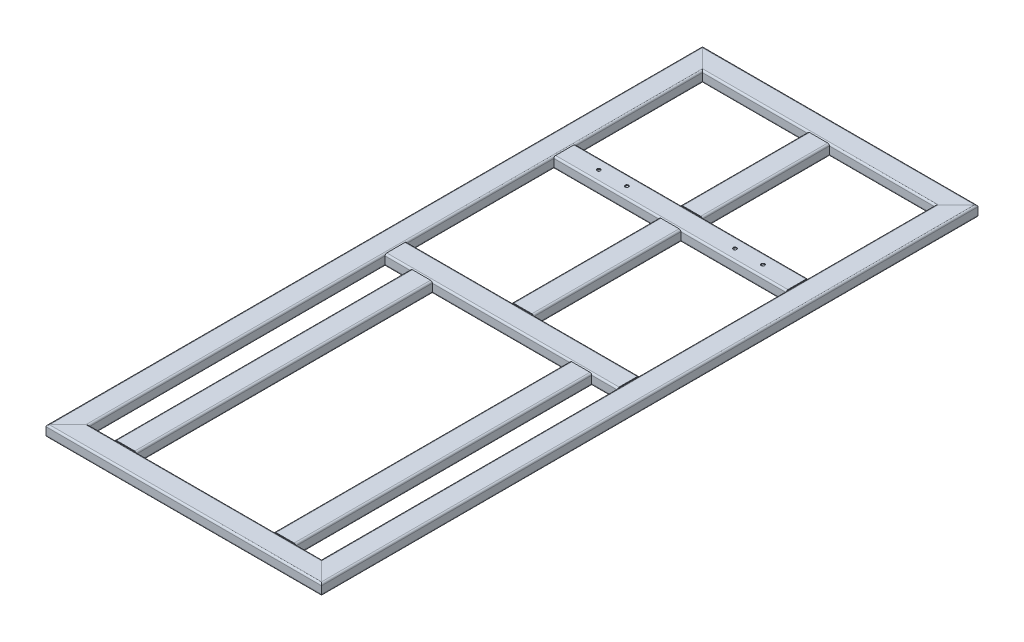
SolidWorks part; units mm, degrees
ref_plane "Piano frontale" through (0, 0, 0) normal (0, 0, 1) x (1, 0, 0)
ref_plane "Piano superiore" through (0, 0, 0) normal (0, 1, 0) x (1, 0, 0)
ref_plane "Piano destro" through (0, 0, 0) normal (1, 0, 0) x (0, 0, -1)
sketch "Schizzo1" plane through (0, 0, 0) normal (0, 1, 0) x (1, 0, 0)
  line L0 (-470, 0) -> (470, 0)
  line L1 (470, -1175) -> (-470, -1175)
  line L2 (470, -1175) -> (470, 1175)
  line L3 (470, 1175) -> (-470, 1175)
  line L4 (-470, -1175) -> (-470, 1175)
  line L5 (470, -1175) -> (-470, 1175) construction
  line L6 (470, 1175) -> (-470, -1175) construction
  line L7 (0, 625) -> (0, 0)
  line L8 (-295, 0) -> (-295, -1175)
  line L9 (295, 0) -> (295, -1175)
  line L10 (0, 0) -> (0, -1175) construction
  line L11 (105, 1135) -> (225, 1135) construction
  line L12 (-500, -1235) -> (500, -1235)
  line L13 (-105, 1135) -> (-225, 1135) construction
  line L14 (-470, 625) -> (470, 625)
  line L15 (-500, 1235) -> (500, 1235) construction
  line L16 (0, 625) -> (0, 1175)
  point P0 (0, 0)
  point P22 (0, -1235)
  dimension "D1" = 2350
  dimension "D2" = 940
  dimension "D3" = 175
  dimension "D4" = 60
  dimension "D5" = 60
  dimension "D6" = 1000
  dimension "D7" = 105
  dimension "D8" = 120
  dimension "D9" = 40
  dimension "D10" = 550
other "Tubo rettangolare 80 X 40 X 3.0(1)"
ref_plane "Piano4" through (-470, 0, 1175) normal (0, 0, -1) x (0, 1, 0)
sketch "Sketch128" plane through (-470, 0, 1175) normal (0, 0, -1) x (0, 1, 0)
  line L0 (-13.6, -37) -> (13.6, -37)
  line L1 (-17, -33.6) -> (-17, 33.6)
  line L2 (13.6, 37) -> (-13.6, 37)
  line L3 (17, 33.6) -> (17, -33.6)
  line L4 (-13.6, -40) -> (13.6, -40)
  line L5 (-20, -33.6) -> (-20, 33.6)
  line L6 (13.6, 40) -> (-13.6, 40)
  line L7 (20, 33.6) -> (20, -33.6)
  line L8 (-20, 0) -> (-17, 0) construction
  line L9 (-17, 0) -> (17, 0) construction
  line L10 (17, 0) -> (20, 0) construction
  line L11 (0, 40) -> (0, 37) construction
  line L12 (0, 37) -> (0, -37) construction
  line L13 (0, -37) -> (0, -40) construction
  arc A0 (20, 33.6) -> (13.6, 40) centre (13.6, 33.6) ccw
  arc A1 (13.6, -40) -> (20, -33.6) centre (13.6, -33.6) ccw
  arc A2 (-20, -33.6) -> (-13.6, -40) centre (-13.6, -33.6) ccw
  arc A3 (-13.6, 40) -> (-20, 33.6) centre (-13.6, 33.6) ccw
  arc A4 (-13.6, 37) -> (-17, 33.6) centre (-13.6, 33.6) ccw
  arc A5 (17, 33.6) -> (13.6, 37) centre (13.6, 33.6) ccw
  arc A6 (13.6, -37) -> (17, -33.6) centre (13.6, -33.6) ccw
  arc A7 (-17, -33.6) -> (-13.6, -37) centre (-13.6, -33.6) ccw
  point P6 (-20, 40)
  point P33 (-20, -40)
  point P34 (20, -40)
  point P36 (20, 40)
  point P37 (0, 0)
  dimension "D1" = 6.4
  dimension "Thickness" = 3
  dimension "V_leg" = 80
  dimension "H_leg" = 40
other "Tubo rettangolare 80 X 40 X 3.0(2)"
ref_plane "Piano7" through (-470, 0, 0) normal (1, 0, 0) x (0, 1, 0)
sketch "Sketch129" plane through (-470, 0, 0) normal (1, 0, 0) x (0, 1, 0)
  line L0 (-13.6, -37) -> (13.6, -37)
  line L1 (-17, -33.6) -> (-17, 33.6)
  line L2 (13.6, 37) -> (-13.6, 37)
  line L3 (17, 33.6) -> (17, -33.6)
  line L4 (-13.6, -40) -> (13.6, -40)
  line L5 (-20, -33.6) -> (-20, 33.6)
  line L6 (13.6, 40) -> (-13.6, 40)
  line L7 (20, 33.6) -> (20, -33.6)
  line L8 (-20, 0) -> (-17, 0) construction
  line L9 (-17, 0) -> (17, 0) construction
  line L10 (17, 0) -> (20, 0) construction
  line L11 (0, 40) -> (0, 37) construction
  line L12 (0, 37) -> (0, -37) construction
  line L13 (0, -37) -> (0, -40) construction
  arc A0 (20, 33.6) -> (13.6, 40) centre (13.6, 33.6) ccw
  arc A1 (13.6, -40) -> (20, -33.6) centre (13.6, -33.6) ccw
  arc A2 (-20, -33.6) -> (-13.6, -40) centre (-13.6, -33.6) ccw
  arc A3 (-13.6, 40) -> (-20, 33.6) centre (-13.6, 33.6) ccw
  arc A4 (-13.6, 37) -> (-17, 33.6) centre (-13.6, 33.6) ccw
  arc A5 (17, 33.6) -> (13.6, 37) centre (13.6, 33.6) ccw
  arc A6 (13.6, -37) -> (17, -33.6) centre (13.6, -33.6) ccw
  arc A7 (-17, -33.6) -> (-13.6, -37) centre (-13.6, -33.6) ccw
  point P6 (-20, 40)
  point P33 (-20, -40)
  point P34 (20, -40)
  point P36 (20, 40)
  point P37 (0, 0)
  dimension "D1" = 6.4
  dimension "Thickness" = 3
  dimension "V_leg" = 80
  dimension "H_leg" = 40
other "Tubo rettangolare 80 X 40 X 3.0(3)"
ref_plane "Piano11" through (-295, 0, 0) normal (0, 0, 1) x (0, 1, 0)
sketch "Sketch130" plane through (-295, 0, 0) normal (0, 0, 1) x (0, 1, 0)
  line L0 (-13.6, -37) -> (13.6, -37)
  line L1 (-17, -33.6) -> (-17, 33.6)
  line L2 (13.6, 37) -> (-13.6, 37)
  line L3 (17, 33.6) -> (17, -33.6)
  line L4 (-13.6, -40) -> (13.6, -40)
  line L5 (-20, -33.6) -> (-20, 33.6)
  line L6 (13.6, 40) -> (-13.6, 40)
  line L7 (20, 33.6) -> (20, -33.6)
  line L8 (-20, 0) -> (-17, 0) construction
  line L9 (-17, 0) -> (17, 0) construction
  line L10 (17, 0) -> (20, 0) construction
  line L11 (0, 40) -> (0, 37) construction
  line L12 (0, 37) -> (0, -37) construction
  line L13 (0, -37) -> (0, -40) construction
  arc A0 (20, 33.6) -> (13.6, 40) centre (13.6, 33.6) ccw
  arc A1 (13.6, -40) -> (20, -33.6) centre (13.6, -33.6) ccw
  arc A2 (-20, -33.6) -> (-13.6, -40) centre (-13.6, -33.6) ccw
  arc A3 (-13.6, 40) -> (-20, 33.6) centre (-13.6, 33.6) ccw
  arc A4 (-13.6, 37) -> (-17, 33.6) centre (-13.6, 33.6) ccw
  arc A5 (17, 33.6) -> (13.6, 37) centre (13.6, 33.6) ccw
  arc A6 (13.6, -37) -> (17, -33.6) centre (13.6, -33.6) ccw
  arc A7 (-17, -33.6) -> (-13.6, -37) centre (-13.6, -33.6) ccw
  point P6 (-20, 40)
  point P33 (-20, -40)
  point P34 (20, -40)
  point P36 (20, 40)
  point P37 (0, 0)
  dimension "D1" = 6.4
  dimension "Thickness" = 3
  dimension "V_leg" = 80
  dimension "H_leg" = 40
other "Accorcia/Estendi1"
other "Accorcia/Estendi2"
other "Accorcia/Estendi4"
other "Accorcia/Estendi3"
other "Accorcia/Estendi5"
sketch "Schizzo14" [suppressed] plane through (0, 10, 0) normal (0, 1, 0) x (1, 0, 0)
  line L0 (-300, -760) -> (-300, -20) construction
  line L1 (-510, -760) -> (510, -760) construction
  line L3 (-300, 0) -> (-300, -720) construction
  line L4 (0, 0) -> (0, -820) construction
  line L5 (-335.2, -20) -> (-264.8, -20) construction
  line L6 (300, -760) -> (300, -20) construction
  line L10 (510, 760) -> (-510, 760) construction
  line L12 (0, 0) -> (0, 820) construction
  dimension "D2" = 60
  dimension "D3" = 60
sketch3d "Schizzo3D1" [suppressed]
  line L0 (-300, 10, 760) -> (-300, 37.5, 760) construction
  line L1 (300, 10, 760) -> (300, 37.5, 760) construction
  line L2 (300, 10, 20) -> (300, 37.5, 20) construction
  line L3 (-300, 10, 20) -> (-300, 37.5, 20) construction
  line L4 (-300, 17.5, 20) -> (-300, 17.5, 760)
  line L5 (-300, 37.5, 760) -> (-300, 37.5, 20) construction
  line L6 (300, 37.5, 760) -> (300, 37.5, 20) construction
  line L13 (300, 17.5, 20) -> (300, 17.5, 760)
other "Tubo rettangolare 60 X 20 X 2.0(6)"
ref_plane "Piano8" through (-354.5, 20, 20) normal (0, 0, 1) x (0, 1, 0)
sketch "Sketch111" plane through (-354.5, 20, 20) normal (0, 0, 1) x (0, 1, 0)
  line L0 (-6.8, -28) -> (6.8, -28)
  line L1 (-8, -26.8) -> (-8, 26.8)
  line L2 (6.8, 28) -> (-6.8, 28)
  line L3 (8, 26.8) -> (8, -26.8)
  line L4 (-6.8, -30) -> (6.8, -30)
  line L5 (-10, -26.8) -> (-10, 26.8)
  line L6 (6.8, 30) -> (-6.8, 30)
  line L7 (10, 26.8) -> (10, -26.8)
  line L8 (-10, 0) -> (-8, 0) construction
  line L9 (-8, 0) -> (8, 0) construction
  line L10 (8, 0) -> (10, 0) construction
  line L11 (0, 30) -> (0, 28) construction
  line L12 (0, 28) -> (0, -28) construction
  line L13 (0, -28) -> (0, -30) construction
  arc A0 (10, 26.8) -> (6.8, 30) centre (6.8, 26.8) ccw
  arc A1 (6.8, -30) -> (10, -26.8) centre (6.8, -26.8) ccw
  arc A2 (-10, -26.8) -> (-6.8, -30) centre (-6.8, -26.8) ccw
  arc A3 (-6.8, 30) -> (-10, 26.8) centre (-6.8, 26.8) ccw
  arc A4 (-6.8, 28) -> (-8, 26.8) centre (-6.8, 26.8) ccw
  arc A5 (8, 26.8) -> (6.8, 28) centre (6.8, 26.8) ccw
  arc A6 (6.8, -28) -> (8, -26.8) centre (6.8, -26.8) ccw
  arc A7 (-8, -26.8) -> (-6.8, -28) centre (-6.8, -26.8) ccw
  point P6 (-10, 30)
  point P33 (-10, -30)
  point P34 (10, -30)
  point P36 (10, 30)
  point P37 (0, 0)
other "Tubo rettangolare 60 X 20 X 2.0(3)"
ref_plane "Piano9" through (135, 20, -750) normal (0, 0, 1) x (0, 1, 0)
sketch "Sketch110" plane through (135, 20, -750) normal (0, 0, 1) x (0, 1, 0)
  line L0 (-6.8, -28) -> (6.8, -28)
  line L1 (-8, -26.8) -> (-8, 26.8)
  line L2 (6.8, 28) -> (-6.8, 28)
  line L3 (8, 26.8) -> (8, -26.8)
  line L4 (-6.8, -30) -> (6.8, -30)
  line L5 (-10, -26.8) -> (-10, 26.8)
  line L6 (6.8, 30) -> (-6.8, 30)
  line L7 (10, 26.8) -> (10, -26.8)
  line L8 (-10, 0) -> (-8, 0) construction
  line L9 (-8, 0) -> (8, 0) construction
  line L10 (8, 0) -> (10, 0) construction
  line L11 (0, 30) -> (0, 28) construction
  line L12 (0, 28) -> (0, -28) construction
  line L13 (0, -28) -> (0, -30) construction
  arc A0 (10, 26.8) -> (6.8, 30) centre (6.8, 26.8) ccw
  arc A1 (6.8, -30) -> (10, -26.8) centre (6.8, -26.8) ccw
  arc A2 (-10, -26.8) -> (-6.8, -30) centre (-6.8, -26.8) ccw
  arc A3 (-6.8, 30) -> (-10, 26.8) centre (-6.8, 26.8) ccw
  arc A4 (-6.8, 28) -> (-8, 26.8) centre (-6.8, 26.8) ccw
  arc A5 (8, 26.8) -> (6.8, 28) centre (6.8, 26.8) ccw
  arc A6 (6.8, -28) -> (8, -26.8) centre (6.8, -26.8) ccw
  arc A7 (-8, -26.8) -> (-6.8, -28) centre (-6.8, -26.8) ccw
  point P6 (-10, 30)
  point P33 (-10, -30)
  point P34 (10, -30)
  point P36 (10, 30)
  point P37 (0, 0)
other "Tubo rettangolare 60 X 15 X 2.0(1)"
ref_plane "Piano10" through (-354.5, 37.5, 750) normal (0, 0, -1) x (0, -1, 0)
sketch "Sketch1" plane through (-354.5, 37.5, 750) normal (0, 0, -1) x (0, -1, 0)
  line L0 (-4.3, -28) -> (4.3, -28)
  line L1 (-5.5, -26.8) -> (-5.5, 26.8)
  line L2 (4.3, 28) -> (-4.3, 28)
  line L3 (5.5, 26.8) -> (5.5, -26.8)
  line L4 (-4.3, -30) -> (4.3, -30)
  line L5 (-7.5, -26.8) -> (-7.5, 26.8)
  line L6 (4.3, 30) -> (-4.3, 30)
  line L7 (7.5, 26.8) -> (7.5, -26.8)
  line L8 (-7.5, 0) -> (-5.5, 0) construction
  line L9 (-5.5, 0) -> (5.5, 0) construction
  line L10 (5.5, 0) -> (7.5, 0) construction
  line L11 (0, 30) -> (0, 28) construction
  line L12 (0, 28) -> (0, -28) construction
  line L13 (0, -28) -> (0, -30) construction
  arc A0 (7.5, 26.8) -> (4.3, 30) centre (4.3, 26.8) ccw
  arc A1 (4.3, -30) -> (7.5, -26.8) centre (4.3, -26.8) ccw
  arc A2 (-7.5, -26.8) -> (-4.3, -30) centre (-4.3, -26.8) ccw
  arc A3 (-4.3, 30) -> (-7.5, 26.8) centre (-4.3, 26.8) ccw
  arc A4 (-4.3, 28) -> (-5.5, 26.8) centre (-4.3, 26.8) ccw
  arc A5 (5.5, 26.8) -> (4.3, 28) centre (4.3, 26.8) ccw
  arc A6 (4.3, -28) -> (5.5, -26.8) centre (4.3, -26.8) ccw
  arc A7 (-5.5, -26.8) -> (-4.3, -28) centre (-4.3, -26.8) ccw
  point P6 (-7.5, 30)
  point P33 (-7.5, -30)
  point P34 (7.5, -30)
  point P36 (7.5, 30)
  point P37 (0, 0)
sketch "Schizzo16" [suppressed] plane through (0, 0, 0) normal (0, 0, 1) x (1, 0, 0)
  line L0 (440, 0) -> (-440, 0) construction
  line L1 (440, -6.8) -> (440, 6.8) construction
  line L2 (-440, -6.8) -> (-440, 6.8) construction
  line L3 (354.5, 28) -> (354.5, -10) construction
  line L4 (381.3, 28) -> (327.7, 28) construction
  line L5 (440, -10) -> (-440, -10) construction
  line L6 (0, 0) -> (0, -6.8) construction
  line L7 (-500, -6.8) -> (500, -6.8) construction
  circle A0 centre (354.5, 0) radius 5
  circle A1 centre (-354.5, 0) radius 5
  dimension "D1" = 10
extrude "Taglio-Estrusione2" [suppressed] cut sketch "Schizzo16" along normal blind 720
other "Tubo rettangolare 80 X 15 X 2.0(3)"
ref_plane "Piano12" through (-300, 17.5, 20) normal (0, 0, 1) x (0, 1, 0)
sketch "Sketch116" plane through (-300, 17.5, 20) normal (0, 0, 1) x (0, 1, 0)
  line L0 (-2.7, -38) -> (2.7, -38)
  line L1 (-5.5, -35.2) -> (-5.5, 35.2)
  line L2 (2.7, 38) -> (-2.7, 38)
  line L3 (5.5, 35.2) -> (5.5, -35.2)
  line L4 (-2.7, -40) -> (2.7, -40)
  line L5 (-7.5, -35.2) -> (-7.5, 35.2)
  line L6 (2.7, 40) -> (-2.7, 40)
  line L7 (7.5, 35.2) -> (7.5, -35.2)
  line L8 (-7.5, 0) -> (-5.5, 0) construction
  line L9 (-5.5, 0) -> (5.5, 0) construction
  line L10 (5.5, 0) -> (7.5, 0) construction
  line L11 (0, 40) -> (0, 38) construction
  line L12 (0, 38) -> (0, -38) construction
  line L13 (0, -38) -> (0, -40) construction
  arc A0 (7.5, 35.2) -> (2.7, 40) centre (2.7, 35.2) ccw
  arc A1 (2.7, -40) -> (7.5, -35.2) centre (2.7, -35.2) ccw
  arc A2 (-7.5, -35.2) -> (-2.7, -40) centre (-2.7, -35.2) ccw
  arc A3 (-2.7, 40) -> (-7.5, 35.2) centre (-2.7, 35.2) ccw
  arc A4 (-2.7, 38) -> (-5.5, 35.2) centre (-2.7, 35.2) ccw
  arc A5 (5.5, 35.2) -> (2.7, 38) centre (2.7, 35.2) ccw
  arc A6 (2.7, -38) -> (5.5, -35.2) centre (2.7, -35.2) ccw
  arc A7 (-5.5, -35.2) -> (-2.7, -38) centre (-2.7, -35.2) ccw
  point P6 (-7.5, 40)
  point P33 (-7.5, -40)
  point P34 (7.5, -40)
  point P36 (7.5, 40)
  point P37 (0, 0)
sketch "Schizzo15" plane through (0, 0, 0) normal (0, 0, 1) x (1, 0, 0)
  circle A0 centre (0, 0) radius 10
  dimension "D1" = 20
extrude "Taglio-Estrusione1" cut sketch "Schizzo15" against normal blind 1180
sketch "Schizzo18" plane through (0, 20, 0) normal (0, 1, 0) x (1, 0, 0)
  circle A4 centre (303.95, 625) radius 6.5
  circle A5 centre (200.05, 625) radius 6.5
  circle A6 centre (-200.05, 625) radius 6.5
  circle A7 centre (-303.95, 625) radius 6.5
  dimension "D1" = 13
extrude "Taglio-Estrusione4" cut sketch "Schizzo18" against normal up to surface (40 mm away)
sketch "Schizzo17" plane through (0, 0, 0) normal (1, 0, 0) x (0, 0, -1)
  line L0 (625, 20) -> (625, -20) construction
  line L1 (631.5, 20) -> (618.5, 20) construction
  line L2 (618.5, -20) -> (631.5, -20) construction
  circle A0 centre (0, 0) radius 10
  circle A1 centre (625, 0) radius 10
  dimension "D1" = 20
extrude "Taglio-Estrusione3" cut sketch "Schizzo17" along normal blind 480 and the other way blind 480
sketch "Schizzo19" plane through (0, 0, 0) normal (0, 0, 1) x (1, 0, 0)
  line L0 (-295, 20) -> (-295, -20) construction
  line L1 (-261.4, 20) -> (-328.6, 20) construction
  line L2 (-328.6, -20) -> (-261.4, -20) construction
  line L3 (0, 0) -> (0, -20) construction
  line L4 (430, -20) -> (-430, -20) construction
  circle A0 centre (-295, 0) radius 10
  circle A1 centre (295, 0) radius 10
  dimension "D1" = 20
extrude "Taglio-Estrusione5" cut sketch "Schizzo19" along normal blind 1180
sketch "Schizzo20" plane through (0, -20, 0) normal (0, -1, 0) x (1, 0, 0)
  circle A0 centre (303.95, -625) radius 15
  point P2 (-200.05, -625)
  point P3 (200.05, -625)
  point P7 (-303.95, -625)
  dimension "D1" = 30
extrude "Taglio-Estrusione6" cut sketch "Schizzo20" against normal blind 10
pattern_sketch "Ripetizione-Schizzo1" of "Taglio-Estrusione6"
sketch "Linee di piegatura1" [suppressed] plane through (0, 0, 0) normal (0, 1, 0) x (1, 0, 0)
sketch "Casella di contorno1" [suppressed] plane through (0, 0, 0) normal (0, 1, 0) x (1, 0, 0)
equation "\"Lam_vern\"= 2 * ( \"SW-Massa\" / \"SW-Densità\" ) / ( \"Spessore\" / 1000 )"
equation "\"D1@Sketch110\"=1.6*\"Thickness@Sketch110\""
equation "\"D1@Sketch111\"=1.6*\"Thickness@Sketch111\""
equation "\"D1@Sketch1\"=1.6*\"Thickness@Sketch1\""
equation "\"D3@Schizzo3D1\"=\"D4@Schizzo3D1\""
equation "\"D1@Sketch116\"=\"Thickness@Sketch116\"*2.4"
